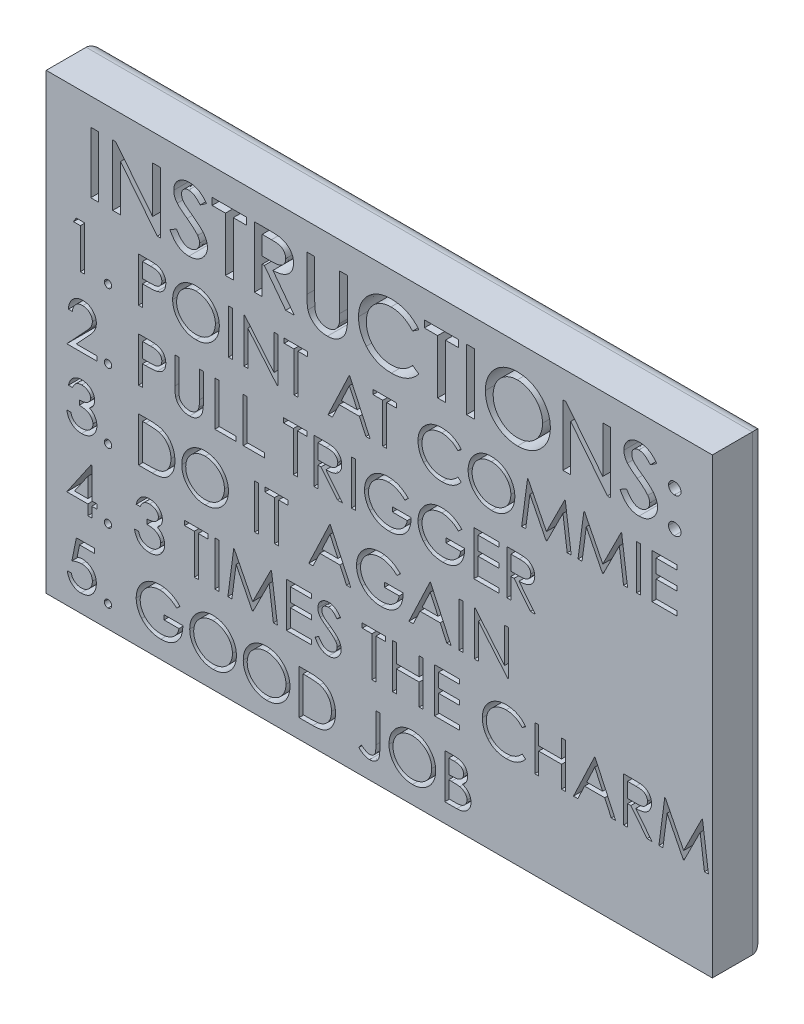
SolidWorks part; units mm, degrees
ref_plane "Front Plane" through (0, 0, 0) normal (0, 0, 1) x (1, 0, 0)
ref_plane "Top Plane" through (0, 0, 0) normal (0, 1, 0) x (1, 0, 0)
ref_plane "Right Plane" through (0, 0, 0) normal (1, 0, 0) x (0, 0, -1)
sketch "Sketch1" plane through (0, 0, 0) normal (0, 0, 1) x (1, 0, 0)
  line L1 (-15.875, -10.795) -> (15.875, -10.795)
  line L2 (-15.875, -10.795) -> (-15.875, 10.795)
  line L3 (-15.875, 10.795) -> (15.875, 10.795)
  line L4 (15.875, -10.795) -> (15.875, 10.795)
  line L5 (-15.875, -10.795) -> (15.875, 10.795) construction
  line L6 (-15.875, 10.795) -> (15.875, -10.795) construction
  point P0 (0, 0)
  dimension "D1" = 31.75
  dimension "D2" = 21.59
extrude "Boss-Extrude1" add sketch "Sketch1" along normal blind 2.54
fillet "Fillet1" radius 0.635 4 edges at (-15.875, 0, 0) (0, -10.795, 0) (0, 10.795, 0) (15.875, 0, 0)
sketch "Sketch2" plane through (0, 0, 2.54) normal (0, 0, 1) x (1, 0, 0)
  line L0 (-15.875, 10.795) -> (-14.977, 9.897) construction
  line L1 (-14.977, 9.897) -> (-14.977, 6.598) construction
  line L2 (-14.977, 6.598) -> (-14.977, 3.299) construction
  line L3 (-14.977, 3.299) -> (-14.977, 0) construction
  line L4 (-14.977, 0) -> (-14.977, -3.299) construction
  line L5 (-14.977, -3.299) -> (-14.977, -6.598) construction
  line L6 (-14.977, -6.598) -> (-14.977, -9.897) construction
  line L7 (-14.977, -9.897) -> (-15.875, -10.795) construction
  line L8 (15.875, 10.795) -> (-15.875, 10.795) construction
  line L9 (-15.875, -10.795) -> (15.875, -10.795) construction
  line L10 (-14.977, -9.897) -> (14.977, -9.897) construction
  line L11 (14.977, -9.897) -> (15.875, -10.795) construction
  line L12 (14.977, -9.897) -> (14.977, -6.598) construction
  line L13 (14.977, -6.598) -> (14.977, -3.299) construction
  line L14 (14.977, -3.299) -> (14.977, 0) construction
  line L15 (14.977, 0) -> (14.977, 3.299) construction
  line L16 (14.977, 3.299) -> (14.977, 6.598) construction
  line L17 (14.977, 6.598) -> (14.977, 9.897) construction
  line L18 (14.977, 9.897) -> (15.875, 10.795) construction
  line L19 (-14.977, 9.897) -> (14.977, 9.897) construction
  line L20 (-14.977, 6.598) -> (14.977, 6.598) construction
  line L21 (-14.977, 3.299) -> (14.977, 3.299) construction
  line L22 (-14.977, 0) -> (14.977, 0) construction
  line L23 (-14.977, -3.299) -> (14.977, -3.299) construction
  line L24 (-14.977, -6.598) -> (14.977, -6.598) construction
  text T0 "<b>INSTRUCTIONS:</b>" font "Century Gothic" height in points 11
  text T1 "1. POINT AT COMMIE" font "Century Gothic" height in points 8
  text T2 "2. PULL TRIGGER" font "Century Gothic" height in points 8
  text T3 "3. DO IT AGAIN" font "Century Gothic" height in points 8
  text T4 "4. 3 TIMES THE CHARM" font "Century Gothic" height in points 8
  text T5 "5. GOOD JOB" font "Century Gothic" height in points 8
  dimension "D1" = 45
  dimension "D2" = 45
  dimension "D3" = 1.27
extrude "Cut-Extrude1" cut sketch "Sketch2" against normal blind 1.905
